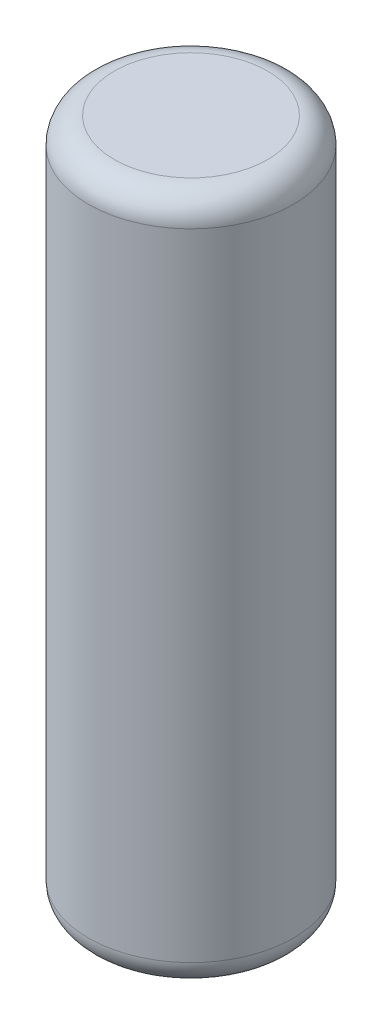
SolidWorks part; units mm, degrees
ref_plane "Front Plane" through (0, 0, 0) normal (0, 0, 1) x (1, 0, 0)
ref_plane "Top Plane" through (0, 0, 0) normal (0, 1, 0) x (1, 0, 0)
ref_plane "Right Plane" through (0, 0, 0) normal (1, 0, 0) x (0, 0, -1)
sketch "Sketch1" plane through (0, 0, 0) normal (0, 1, 0) x (1, 0, 0)
  circle A0 centre (0, 0) radius 1.19
extrude "Extrude1" add sketch "Sketch1" along normal blind 7.9735
fillet "Fillet1" radius 0.3 1 edges at (0, 7.9735, 1.19)
fillet "Fillet2" radius 0.3 1 edges at (0, 0, 1.19)
